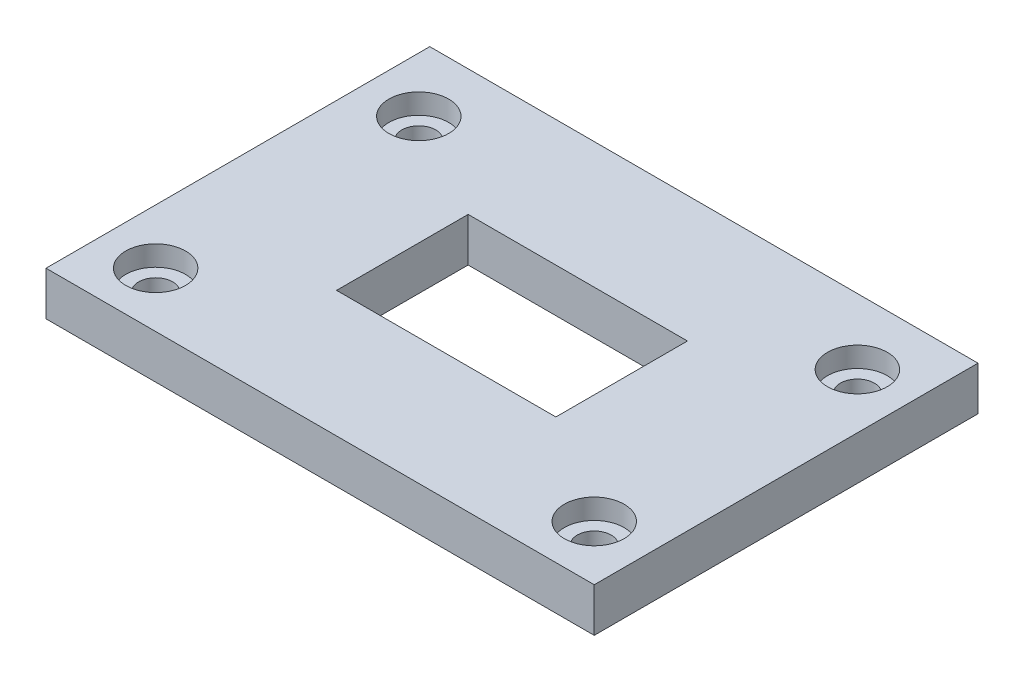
SolidWorks part; units mm, degrees
ref_plane "Front" through (0, 0, 0) normal (0, 0, 1) x (1, 0, 0)
ref_plane "Top" through (0, 0, 0) normal (0, 1, 0) x (1, 0, 0)
ref_plane "Right" through (0, 0, 0) normal (1, 0, 0) x (0, 0, -1)
sketch "Sketch1" plane through (0, 0, 0) normal (0, 1, 0) x (1, 0, 0)
  line L0 (125, -87.5) -> (-125, 87.5) construction
  line L1 (-125, 87.5) -> (125, 87.5)
  line L2 (-125, 87.5) -> (-125, -87.5)
  line L3 (-125, -87.5) -> (125, -87.5)
  line L4 (125, 87.5) -> (125, -87.5)
  dimension "D1" = 250
  dimension "D2" = 175
extrude "Extrude1" add sketch "Sketch1" along normal blind 20
hole_wizard "CBORE for M14 Hex Head Bolt1" positions "Sketch3" profile "Sketch2" counterbore size "M14" standard "Ansi Metric"
sketch "Sketch3" plane through (0, 20, 0) normal (0, 1, 0) x (-1, 0, 0)
  line L0 (125, -87.5) -> (125, 87.5) construction
  line L1 (125, 87.5) -> (-125, 87.5) construction
  point P0 (100, 62.5)
  point P1 (100, -57.5)
  point P2 (-100, 62.5)
  point P3 (-100, -57.5)
  dimension "D1" = 25
  dimension "D2" = 25
  dimension "D3" = 120
  dimension "D4" = 200
sketch "Sketch2" plane through (-100, 20, 62.5) normal (1, 0, 0) x (0, 0, 1)
  line L0 (0, 0) -> (0, 20)
  line L1 (0, 20) -> (7.75, 20)
  line L3 (7.75, 20) -> (7.75, 9.25)
  line L4 (7.75, 9.25) -> (13.625, 9.25)
  line L5 (13.625, 9.25) -> (13.625, 0)
  line L7 (13.625, 0) -> (0, 0)
  line L11 (0, -6.35) -> (0, 107.95) construction
  dimension "Thru Hole Dia." = 15.5
  dimension "Thru Hole Depth" = 20
  dimension "C'Bore Dia." = 27.25
  dimension "C'Bore Depth" = 9.25
sketch "Sketch4" plane through (0, 20, 0) normal (0, 1, 0) x (-1, 0, 0)
  line L0 (-50, 30) -> (50, -30) construction
  line L1 (50, -30) -> (-50, -30)
  line L2 (50, -30) -> (50, 30)
  line L3 (50, 30) -> (-50, 30)
  line L4 (-50, -30) -> (-50, 30)
  dimension "D1" = 100
  dimension "D2" = 60
extrude "Cut-Extrude1" cut sketch "Sketch4" against normal through all
